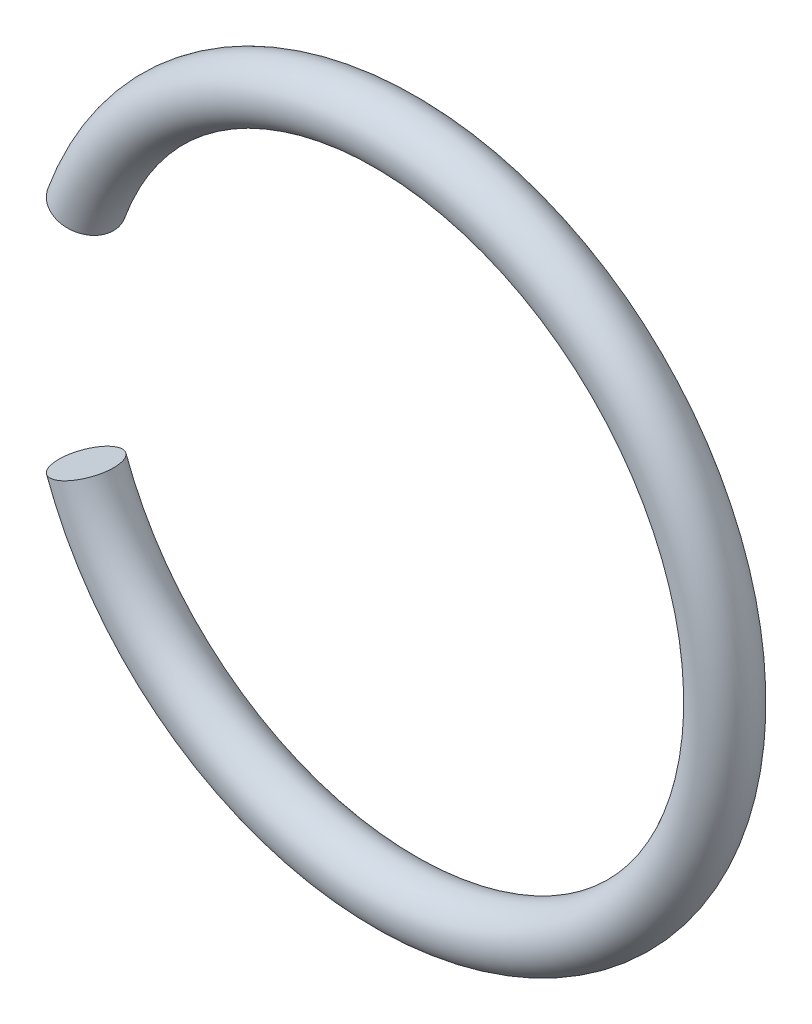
SolidWorks part; units mm, degrees
ref_plane "Front" through (0, 0, 0) normal (0, 0, 1) x (1, 0, 0)
ref_plane "Top" through (0, 0, 0) normal (0, 1, 0) x (1, 0, 0)
ref_plane "Right" through (0, 0, 0) normal (1, 0, 0) x (0, 0, -1)
sketch "Sketch1" plane through (0, 0, 0) normal (0, 0, 1) x (1, 0, 0)
  circle A0 centre (0, 0) radius 8.9154
  dimension "D1" = 17.8308
sketch "Sketch3" plane through (0, 0, 0) normal (0, 1, 0) x (1, 0, 0)
  line L0 (0, 0) -> (8.9154, 0) construction
  circle A0 centre (8.9154, 0) radius 0.7874
  dimension "D2" = 1.5748
  dimension "D1" = 8.9154
sketch "Sketch5" plane through (0, 0, 0) normal (0, 1, 0) x (1, 0, 0)
  line L0 (0, 0) -> (0, -1.2676) construction
revolve "Revolve1" add sketch "Sketch3" angle 320 about L0
